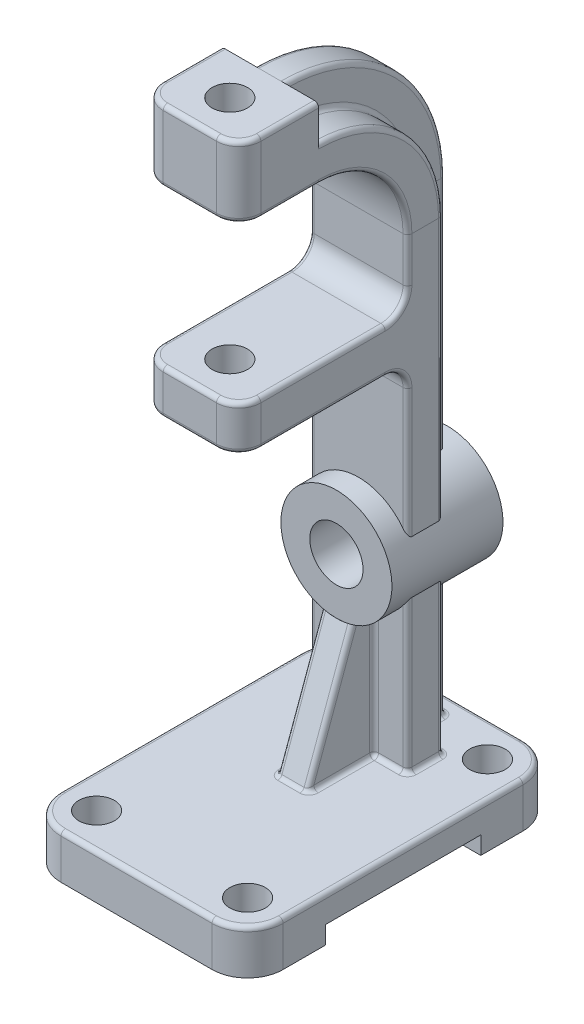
SolidWorks part; units mm, degrees
ref_plane "Front Plane" through (0, 0, 0) normal (0, 0, 1) x (1, 0, 0)
ref_plane "Top Plane" through (0, 0, 0) normal (0, 1, 0) x (1, 0, 0)
ref_plane "Right Plane" through (0, 0, 0) normal (1, 0, 0) x (0, 0, -1)
sketch "Sketch1" plane through (0, 0, 0) normal (0, 0, 1) x (1, 0, 0)
  line L1 (-635, -127) -> (635, -127)
  line L2 (-635, -127) -> (-635, 127)
  line L3 (-635, 127) -> (635, 127)
  line L4 (635, -127) -> (635, 127)
  line L5 (-635, -127) -> (635, 127) construction
  line L6 (-635, 127) -> (635, -127) construction
  point P0 (0, 0)
  dimension "D1" = 1270
  dimension "D2" = 254
extrude "Boss-Extrude1" add sketch "Sketch1" along normal mid plane 1778
sketch "Sketch3" plane through (635, 0, 0) normal (1, 0, 0) x (0, 0, -1)
  line L0 (-889, -127) -> (889, -127) construction
  line L1 (-444.5, -127) -> (444.5, -127)
  line L2 (-444.5, -127) -> (-444.5, -25.4)
  line L3 (-444.5, -25.4) -> (444.5, -25.4)
  line L4 (444.5, -127) -> (444.5, -25.4)
  line L5 (0, 0) -> (0, 311.1432) construction
  dimension "D1" = 889
  dimension "D2" = 101.6
extrude "Cut-Extrude2" cut sketch "Sketch3" against normal through all
sketch "Sketch4" plane through (0, 127, 0) normal (0, 1, 0) x (1, 0, 0)
  line L0 (-279.4, 381) -> (279.4, 381)
  line L1 (279.4, 381) -> (279.4, 584.2)
  line L2 (279.4, 584.2) -> (88.9, 584.2)
  line L3 (88.9, 584.2) -> (88.9, 787.4)
  line L4 (88.9, 787.4) -> (-88.9, 787.4)
  line L5 (-88.9, 787.4) -> (-88.9, 584.2)
  line L6 (-88.9, 584.2) -> (-279.4, 584.2)
  line L7 (-279.4, 584.2) -> (-279.4, 381)
  line L8 (0, 0) -> (0, 981.3991) construction
  line L9 (635, 889) -> (-635, 889) construction
  dimension "D1" = 558.8
  dimension "D2" = 203.2
  dimension "D3" = 406.4
  dimension "D4" = 177.8
  dimension "D5" = 101.6
sketch "Sketch5" plane through (0, 0, 0) normal (1, 0, 0) x (0, 0, -1)
  line L0 (787.4, 127) -> (787.4, 2794)
  line L1 (0, 127) -> (981.3991, 127) construction
  arc A0 (787.4, 2794) -> (-127, 3708.4) centre (-127, 2794) ccw
  dimension "D2" = 914.4
  dimension "D1" = 2667
sweep "Sweep1" add profiles "Sketch4" path "Sketch5"
sketch "Sketch7" plane through (0, 0, 127) normal (0, 0, 1) x (1, 0, 0)
  line L1 (-279.4, 3302) -> (279.4, 3302)
  line L2 (-279.4, 3302) -> (-279.4, 3708.4)
  line L3 (-279.4, 3708.4) -> (279.4, 3708.4)
  line L4 (279.4, 3302) -> (279.4, 3708.4)
  line L6 (279.4, 3302) -> (279.4, 3505.2) construction
  line L7 (-279.4, 3505.2) -> (-279.4, 3302) construction
  line L8 (-279.4, 3302) -> (279.4, 3302) construction
  line L9 (88.9, 3708.4) -> (-88.9, 3708.4) construction
extrude "Boss-Extrude2" add sketch "Sketch7" along normal blind 457.2
sketch "Sketch8" plane through (0, 0, -889) normal (0, 0, -1) x (-1, 0, 0)
  line L0 (-635, 127) -> (635, 127) construction
  circle A0 centre (0, 1143) radius 317.5
  dimension "D2" = 635
  dimension "D1" = 1016
extrude "Boss-Extrude3" add sketch "Sketch8" against normal blind 635
sketch "Sketch9" plane through (0, 0, -889) normal (0, 0, -1) x (-1, 0, 0)
  circle A0 centre (0, 1143) radius 152.4
  dimension "D1" = 304.8
extrude "Cut-Extrude3" cut sketch "Sketch9" against normal through all
sketch "Sketch10" plane through (0, 0, 584.2) normal (0, 0, 1) x (1, 0, 0)
  line L1 (-279.4, 2413) -> (279.4, 2413)
  line L3 (-279.4, 2159) -> (279.4, 2159)
  line L5 (-279.4, 1293.8041) -> (-279.4, 2794) construction
  line L6 (-279.4, 2159) -> (-279.4, 2413)
  line L7 (279.4, 1293.8041) -> (279.4, 2794) construction
  line L8 (279.4, 2159) -> (279.4, 2413)
  line L9 (635, 127) -> (-635, 127) construction
  dimension "D1" = 254
  dimension "D2" = 2032
extrude "Boss-Extrude4" add sketch "Sketch10" against normal up to next
sketch "Sketch12" plane through (0, 0, 0) normal (1, 0, 0) x (0, 0, -1)
  line L0 (254, 825.5) -> (-0.2332, 127)
  line L1 (254, 1460.5) -> (254, 825.5) construction
  line L2 (-889, 127) -> (889, 127) construction
  dimension "D1" = 70
rib "Rib1" sketch "Sketch12" sketch "Sketch12" thickness 177.8 extrusion direction parallel to sketch draft on no parameters "D1"=177.8
fillet "Fillet10" radius 203.2 4 edges at (-635, 0, -889) (635, 0, -889) (-635, 0, 889) (635, 0, 889)
sketch "Sketch13" plane through (0, 127, 0) normal (0, 1, 0) x (1, 0, 0)
  circle A0 centre (-431.8, -685.8) radius 101.6
  circle A1 centre (431.8, -685.8) radius 101.6
  circle A2 centre (431.8, 685.8) radius 101.6
  circle A3 centre (-431.8, 685.8) radius 101.6
  dimension "D1" = 203.2
extrude "Cut-Extrude5" cut sketch "Sketch13" against normal through all
sketch "Sketch18" plane through (0, 3708.4, 0) normal (0, 1, 0) x (1, 0, 0)
  line L0 (279.4, -584.2) -> (-279.4, -584.2) construction
  circle A0 centre (0, -355.6) radius 101.6
  dimension "D1" = 203.2
  dimension "D2" = 228.6
extrude "Cut-Extrude6" cut sketch "Sketch18" against normal up to surface (1549.4 mm away) contours A0
fillet "Fillet11" radius 127 4 edges at (-279.4, 2286, 584.2) (279.4, 2286, 584.2) (-279.4, 3505.2, 584.2) (279.4, 3505.2, 584.2)
fillet "Fillet12" radius 127 2 edges at (0, 2159, -381) (0, 2413, -381)
fillet "Fillet13" radius 25.4 55 edges at (44.9013, 828.691, -255.1614) (-88.9, 482.6, -129.1946) (88.9, 482.6, -381) (88.9, 482.6, -129.1946) (-88.9, 482.6, -381) (0, 2413, 584.2) (0, 2159, 584.2) (242.2026, 2159, 547.0026) (-242.2026, 2159, 547.0026) (242.2026, 2413, 547.0026) (-242.2026, 2413, 547.0026) (0, 3302, 584.2) (0, 3708.4, 584.2) (279.4, 3302, 292.1) (-279.4, 3302, 292.1) (242.2026, 3302, 547.0026) (-242.2026, 3302, 547.0026) (-279.4, 3708.4, 292.1) (279.4, 3708.4, 292.1) (242.2026, 3708.4, 547.0026) (-242.2026, 3708.4, 547.0026) (-279.4, 2159, 101.6) (279.4, 2159, 101.6) (279.4, 2667, -381) (-279.4, 2667, -381) (-279.4, 2413, 101.6) (279.4, 2413, 101.6) (-279.4, 2121.8026, -343.8026) (279.4, 2121.8026, -343.8026) (279.4, 2450.1974, -343.8026) (-279.4, 2450.1974, -343.8026) (-279.4, 559.5979, -381) (279.4, 559.5979, -381) (279.4, 559.5979, -584.2) (88.9, 482.6, -584.2) (88.9, 482.6, -787.4) (-88.9, 482.6, -787.4) (-88.9, 482.6, -584.2) (-279.4, 559.5979, -584.2) (-279.4, 3153.2102, -232.2102) (279.4, 3153.2102, -232.2102) (279.4, 3296.8943, -375.8943) (88.9, 3296.8943, -375.8943) (88.9, 3440.5784, -519.5784) (-88.9, 3440.5784, -519.5784) (-88.9, 3296.8943, -375.8943) (-279.4, 3296.8943, -375.8943) (-88.9, 2120.9, -584.2) (-279.4, 2043.9021, -584.2) (-88.9, 2120.9, -787.4) (88.9, 2120.9, -787.4) (88.9, 2120.9, -584.2) (279.4, 2043.9021, -584.2) (279.4, 1662.9021, -381) (-279.4, 1662.9021, -381)
fillet "Fillet17" radius 25.4 8 edges at (575.4841, 127, 829.4841) (0, 127, 889) (-575.4841, 127, 829.4841) (-635, 127, 0) (-575.4841, 127, -829.4841) (0, 127, -889) (575.4841, 127, -829.4841) (635, 127, 0)
fillet "Fillet19" radius 25.4 24 edges at (96.3395, 127, -373.5605) (184.15, 127, -381) (271.9605, 127, -388.4395) (279.4, 127, -482.6) (271.9605, 127, -576.7605) (184.15, 127, -584.2) (96.3395, 127, -591.6395) (88.9, 127, -685.8) (81.4605, 127, -779.9605) (0, 127, -787.4) (-81.4605, 127, -779.9605) (-88.9, 127, -685.8) (-96.3395, 127, -591.6395) (-184.15, 127, -584.2) (-271.9605, 127, -576.7605) (-279.4, 127, -482.6) (-271.9605, 127, -388.4395) (-184.15, 127, -381) (-96.3395, 127, -373.5605) (-88.9, 127, -191.1985) (-81.4605, 127, -7.6837) (0, 127, 0.2332) (81.4605, 127, -7.6837) (88.9, 127, -191.1985)
